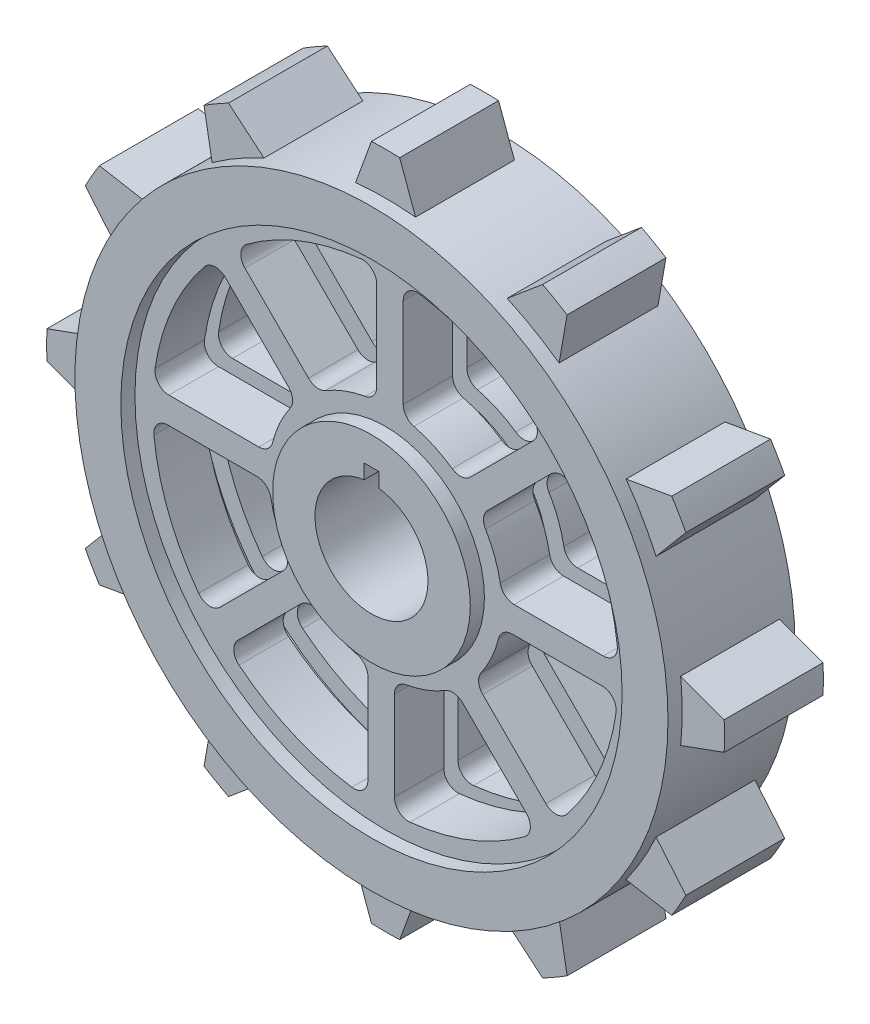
SolidWorks part; units mm, degrees
ref_plane "Front Plane" through (0, 0, 0) normal (0, 0, 1) x (1, 0, 0)
ref_plane "Top Plane" through (0, 0, 0) normal (0, 1, 0) x (1, 0, 0)
ref_plane "Right Plane" through (0, 0, 0) normal (1, 0, 0) x (0, 0, -1)
sketch "Sketch3" plane through (0, 0, 0) normal (0, 0, 1) x (1, 0, 0)
  circle A0 centre (0, 0) radius 21
  dimension "D1" = 42
extrude "Boss-Extrude2" add sketch "Sketch3" along normal mid plane 9
sketch "Sketch4" plane through (0, 0, 4.5) normal (0, 0, 1) x (1, 0, 0)
  line L0 (0, 0) -> (0, 4) construction
  line L1 (-0.525, 3.9654) -> (-0.525, 5)
  line L2 (-0.525, 5) -> (0.525, 5)
  line L3 (0.525, 5) -> (0.525, 3.9654)
  circle A0 centre (0, 0) radius 4
  dimension "D1" = 8
  dimension "D2" = 5
  dimension "1.05" = 1.05
extrude "Cut-Extrude1" cut sketch "Sketch4" against normal through all
sketch "Sketch5" plane through (0, 0, 0) normal (0, 0, 1) x (1, 0, 0)
  circle A0 centre (0, 0) radius 17.75
  circle A1 centre (0, 0) radius 7
  circle A2 centre (0, 0) radius 21 construction
  dimension "D1" = 14
  dimension "D2" = 3.25
extrude "Cut-Extrude5" cut sketch "Sketch5" against normal blind 1
sketch "Sketch6" plane through (0, 0, 4.5) normal (0, 0, 1) x (1, 0, 0)
  circle A0 centre (0, 0) radius 7
  circle A1 centre (0, 0) radius 17.75
  circle A2 centre (0, 0) radius 21 construction
  dimension "D1" = 14
  dimension "D2" = 3.25
extrude "Cut-Extrude6" cut sketch "Sketch6" against normal blind 1
mirror "Mirror2" about plane through (0, 0, 0) normal (0, 0, 1) of "Cut-Extrude6"
sketch "Sketch7" plane through (0, 0, 3.5) normal (0, 0, 1) x (1, 0, 0)
  line L0 (0, 0) -> (0, 17.75) construction
  line L1 (0, 0) -> (12.5511, 12.5511) construction
  line L2 (1.25, 16.4526) -> (1.25, 8.1548)
  line L3 (11.2169, 12.1008) -> (5.3749, 6.2588)
  circle A0 centre (0, 0) radius 17.75 construction
  circle A1 centre (0, 0) radius 17.75 construction
  circle A3 centre (0, 0) radius 8.25
  circle A4 centre (0, 0) radius 7 construction
  circle A6 centre (0, 0) radius 16.5
  dimension "D2" = 1.25
  dimension "D3" = 1.25
  dimension "D1" = 45
  dimension "D4" = 1.25
  dimension "D5" = 1.25
extrude "Cut-Extrude7" cut sketch "Sketch7" against normal through all contours L3 A6 L2 A3
fillet "Fillet1" radius 1 8 edges at (1.25, 16.4526, -2.25) (1.25, 16.4526, 1.75) (11.2169, 12.1008, 1.75) (11.2169, 12.1008, -2.25) (5.3749, 6.2588, 1.75) (5.3749, 6.2588, -2.25) (1.25, 8.1548, -2.25) (1.25, 8.1548, 1.75)
pattern_circular "CirPattern1" count 8 over 360 about axis through (0, 0, 0) along (0, 0, 1) of "Fillet1", "Cut-Extrude7"
sketch "Sketch8" plane through (0, 0, 3.5) normal (0, 0, 1) x (1, 0, 0)
  line L0 (0, 0) -> (0, 21) construction
  line L1 (-1, 23.9792) -> (-2.1235, 20.8924)
  line L2 (1, 23.9792) -> (2.1235, 20.8924)
  circle A0 centre (0, 0) radius 21 construction
  arc A1 (1, 23.9792) -> (-1, 23.9792) centre (0, 0) ccw
  arc A2 (2.1235, 20.8924) -> (-2.1235, 20.8924) centre (0, 0) ccw
  dimension "D1" = 3
  dimension "D2" = 40
  dimension "D3" = 2
extrude "Boss-Extrude3" add sketch "Sketch8" against normal blind 7
pattern_circular "CirPattern2" count 12 over 360 about axis through (0, 0, 0) along (0, 0, 1) of "Boss-Extrude3"
